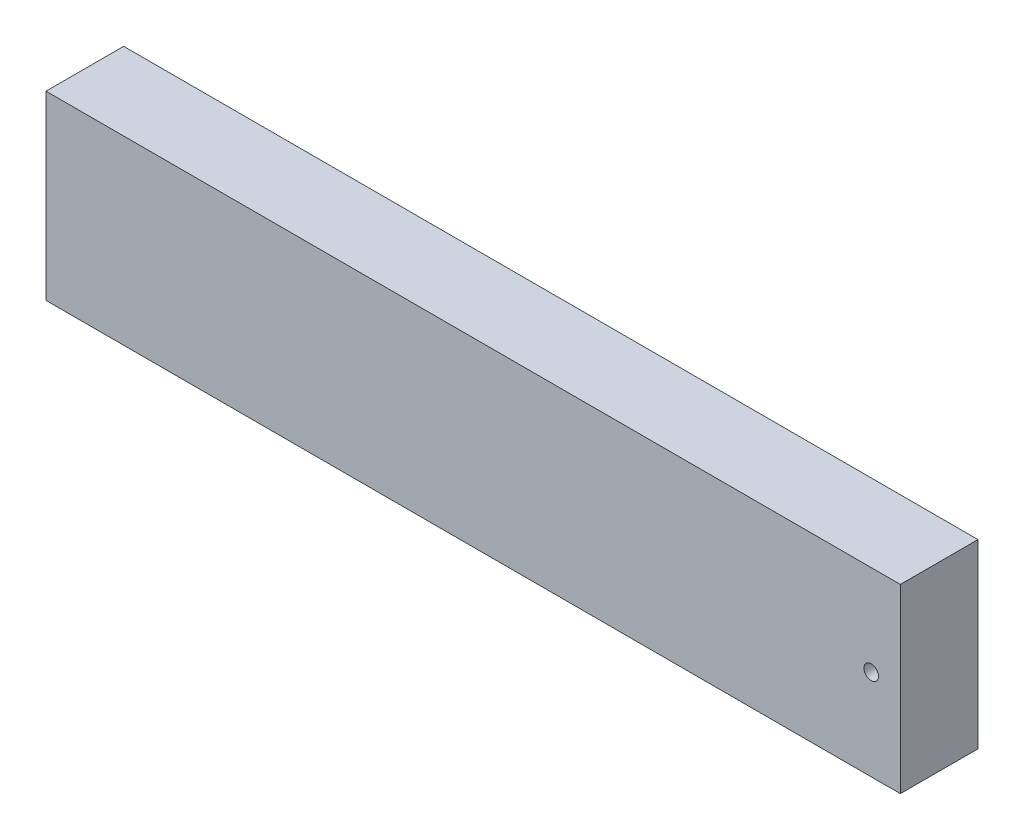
SolidWorks part; units mm, degrees
ref_plane "Front Plane" through (0, 0, 0) normal (0, 0, 1) x (1, 0, 0)
ref_plane "Top Plane" through (0, 0, 0) normal (0, 1, 0) x (1, 0, 0)
ref_plane "Right Plane" through (0, 0, 0) normal (1, 0, 0) x (0, 0, -1)
sketch "Sketch1" plane through (0, 0, 0) normal (0, 0, 1) x (1, 0, 0)
  line L0 (0, 0) -> (0, 88.9)
  line L1 (0, 88.9) -> (419.1, 88.9)
  line L3 (419.1, 0) -> (0, 0)
  line L4 (419.1, 88.9) -> (419.1, 0)
  dimension "D2" = 88.9
  dimension "D3" = 419.1
extrude "Boss-Extrude1" add sketch "Sketch1" along normal blind 38.1
hole_wizard "9/32 (0.28125) Diameter Hole1" positions "Sketch2" profile "Sketch3" hole size "9/32" standard "ANSI Inch"
sketch "Sketch2" plane through (0, 0, 38.1) normal (0, 0, 1) x (1, 0, 0)
  line L0 (0, 88.9) -> (0, 0) construction
  line L2 (0, 0) -> (419.1, 0) construction
  point P2 (404.8125, 44.45)
  dimension "D1" = 404.8125
  dimension "D2" = 44.45
sketch "Sketch3" plane through (404.8125, 44.45, 38.1) normal (1, 0, 0) x (0, -1, 0)
  line L0 (0, 0) -> (0, 38.1)
  line L1 (0, 38.1) -> (3.5719, 38.1)
  line L2 (3.5719, 38.1) -> (3.5719, 0)
  line L5 (3.5719, 0) -> (0, 0)
  line L11 (0, -6.35) -> (0, 107.95) construction
  dimension "Thru Hole Dia." = 7.1437
  dimension "Thru Hole Depth" = 38.1
